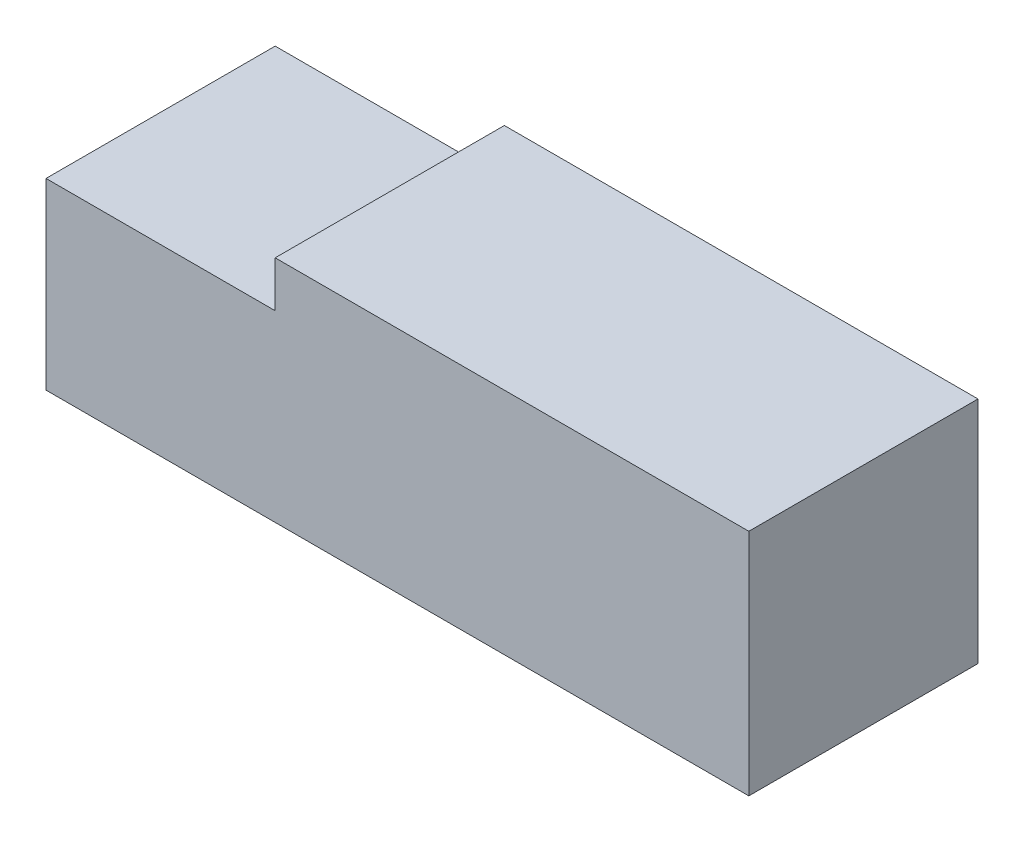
SolidWorks part; units mm, degrees
ref_plane "Front Plane" through (0, 0, 0) normal (0, 0, 1) x (1, 0, 0)
ref_plane "Top Plane" through (0, 0, 0) normal (0, 1, 0) x (1, 0, 0)
ref_plane "Right Plane" through (0, 0, 0) normal (1, 0, 0) x (0, 0, -1)
sketch "Sketch1" plane through (0, 0, 0) normal (0, 1, 0) x (1, 0, 0)
  line L1 (-115, 57.5) -> (115, 57.5)
  line L2 (-115, 57.5) -> (-115, -57.5)
  line L3 (-115, -57.5) -> (115, -57.5)
  line L4 (115, 57.5) -> (115, -57.5)
  line L5 (-115, 57.5) -> (115, -57.5) construction
  line L6 (-115, -57.5) -> (115, 57.5) construction
  point P0 (0, 0)
  dimension "D1" = 230
  dimension "D2" = 115
extrude "Boss-Extrude1" add sketch "Sketch1" along normal mid plane 75
sketch "Sketch2" plane through (0, 37.5, 0) normal (0, 1, 0) x (1, 0, 0)
  line L0 (-115, -57.5) -> (115, -57.5) construction
  line L1 (-115, 57.5) -> (-40, 57.5)
  line L2 (-115, 57.5) -> (-115, -57.5)
  line L3 (-115, -57.5) -> (-40, -57.5)
  line L4 (-40, 57.5) -> (-40, -57.5)
  dimension "D1" = 75
extrude "Cut-Extrude1" cut sketch "Sketch2" against normal blind 15
sketch "Sketch4" plane through (0, 0, 57.5) normal (0, 0, 1) x (1, 0, 0)
  line L0 (-115, 22.5) -> (-115, -37.5) construction
  line L1 (-115, 22.5) -> (-40, 22.5) construction
  line L2 (-40, 22.5) -> (-40, 37.5) construction
  line L3 (-115, -37.5) -> (115, -37.5) construction
  line L4 (-40, 37.5) -> (115, 37.5) construction
  line L5 (115, 37.5) -> (115, -37.5) construction
  line L6 (-115, 22.5) -> (-115, -37.5)
  line L7 (-115, 22.5) -> (-40, 22.5)
  line L8 (-40, 22.5) -> (-40, 37.5)
  line L9 (-115, -37.5) -> (115, -37.5)
  line L10 (-40, 37.5) -> (115, 37.5)
  line L11 (115, 37.5) -> (115, -37.5)
extrude "Cut-Extrude2" cut sketch "Sketch4" against normal blind 40
